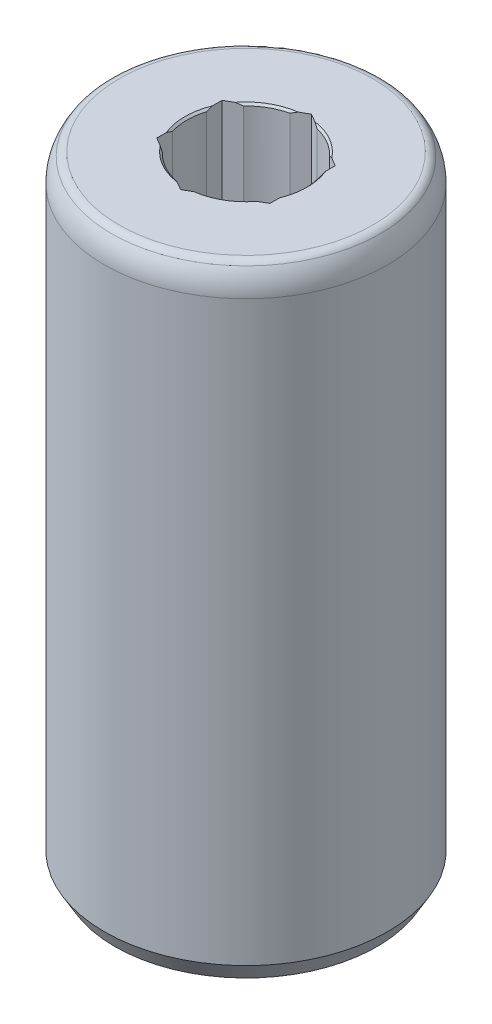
SolidWorks part; units mm, degrees
ref_plane "Front Plane" through (0, 0, 0) normal (0, 0, 1) x (1, 0, 0)
ref_plane "Top Plane" through (0, 0, 0) normal (0, 1, 0) x (1, 0, 0)
ref_plane "Right Plane" through (0, 0, 0) normal (1, 0, 0) x (0, 0, -1)
sketch "Sketch1" plane through (0, 0, 0) normal (0, 0, 1) x (1, 0, 0)
  line L0 (0, -19.05) -> (0, 15.875) construction
  line L1 (0, -8.7313) -> (0, 8.7313) construction
  line L2 (0, -19.05) -> (7.3509, -19.05)
  line L3 (7.9375, -18.034) -> (7.9375, 14.351)
  line L4 (7.1106, 15.875) -> (0, 15.875)
  line L5 (0, 15.875) -> (0, -19.05)
  line L7 (7.3509, -19.05) -> (7.9375, -18.034)
  arc A0 (7.9375, 14.351) -> (7.5275, 15.6573) centre (5.6515, 14.351) ccw
  arc A1 (7.5275, 15.6573) -> (7.1106, 15.875) centre (7.1106, 15.367) ccw
  point P6 (7.9375, -19.05)
  point P13 (7.9375, -19.05)
  dimension "D4" = 1.524
  dimension "D5" = 0.508
  dimension "D2" = 2.286
  dimension "D1" = 34.925
  dimension "D3" = 15.875
  dimension "D6" = 34.925
  dimension "D7" = 1.016
  dimension "D8" = 30
  dimension "D9" = 19.05
revolve "Revolve1" add sketch "Sketch1" angle 360 about L0
hole_wizard "1/4-20 Tapped Hole1" positions "Sketch2" profile "Sketch3" tap size "1/4-20" standard "ANSI Inch"
sketch "Sketch2" plane through (0, -19.05, 0) normal (0, -1, 0) x (-1, 0, 0)
  point P0 (0, 0)
sketch "Sketch3" plane through (0, -19.05, 0) normal (1, 0, 0) x (0, 0, -1)
  line L0 (0, 0) -> (0, 13.7258)
  line L1 (0, 13.7258) -> (2.5527, 12.192)
  line L2 (2.5527, 12.192) -> (2.5527, 0)
  line L5 (2.5527, 0) -> (0, 0)
  line L10 (0, 13.7258) -> (-2.5527, 12.192) construction
  line L11 (0, -6.35) -> (0, 107.95) construction
  dimension "Tap Drill Dia." = 5.1054
  dimension "Tap Drill Depth" = 12.192
  dimension "Drill Angle" = 118
hole_wizard "G (0.261) Diameter Hole1" positions "Sketch4" profile "Sketch5" hole size "G" standard "ANSI Inch"
sketch "Sketch4" plane through (0, 15.875, 0) normal (0, 1, 0) x (1, 0, 0)
  point P0 (0, 0)
sketch "Sketch5" plane through (0, 15.875, 0) normal (1, 0, 0) x (0, 0, 1)
  line L0 (0, 0) -> (0, 8.3417)
  line L1 (0, 8.3417) -> (3.3147, 6.35)
  line L2 (3.3147, 6.35) -> (3.3147, 0)
  line L5 (3.3147, 0) -> (0, 0)
  line L10 (0, 8.3417) -> (-3.3147, 6.35) construction
  line L11 (0, -6.35) -> (0, 107.95) construction
  dimension "Hole Dia." = 6.6294
  dimension "Hole Depth" = 6.35
  dimension "Drill Angle" = 118
sketch "Sketch6" plane through (0, 15.875, 0) normal (0, 1, 0) x (1, 0, 0)
  line L1 (0, 3.6662) -> (-3.175, 1.8331)
  line L2 (-3.175, 1.8331) -> (-3.175, -1.8331)
  line L3 (-3.175, -1.8331) -> (0, -3.6662)
  line L4 (0, -3.6662) -> (3.175, -1.8331)
  line L5 (3.175, -1.8331) -> (3.175, 1.8331)
  line L6 (3.175, 1.8331) -> (0, 3.6662)
  line L7 (0, -8.7313) -> (0, 8.7313) construction
  circle A0 centre (0, 0) radius 3.175 construction
  dimension "D1" = 6.35
  dimension "D2" = 60
extrude "Cut-Extrude1" cut sketch "Sketch6" against normal blind 5.588
sketch "Sketch7" plane through (0, 0, 0) normal (0, 0, 1) x (1, 0, 0)
  line L0 (3.429, 15.875) -> (3.175, 15.621)
  line L1 (7.1106, 15.875) -> (-7.1106, 15.875) construction
  line L2 (3.175, 10.287) -> (3.175, 15.875) construction
  line L3 (3.175, 15.621) -> (3.175, 15.875)
  line L4 (3.175, 15.875) -> (3.429, 15.875)
  line L5 (0, 7.5333) -> (0, 15.875) construction
  dimension "D1" = 45
  dimension "D2" = 0.254
revolve "Cut-Revolve3" cut sketch "Sketch7" angle 360 about L5
